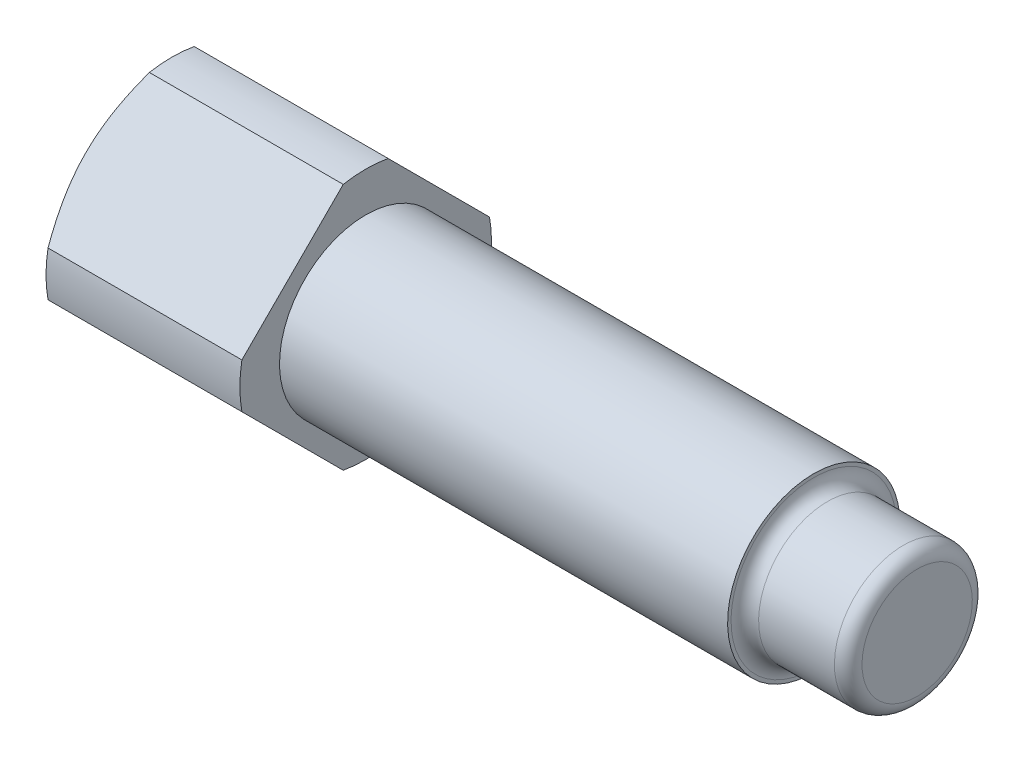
SolidWorks part; units mm, degrees
ref_plane "Front" through (0, 0, 0) normal (0, 0, 1) x (1, 0, 0)
ref_plane "Top" through (0, 0, 0) normal (0, 1, 0) x (1, 0, 0)
ref_plane "Right" through (0, 0, 0) normal (1, 0, 0) x (0, 0, -1)
sketch "Sketch1" plane through (0, 0, 0) normal (1, 0, 0) x (0, 0, -1)
  circle A0 centre (0, 0) radius 3.65
  dimension "e" = 7.3
extrude "BaseHead" add sketch "Sketch1" along normal blind 6
sketch "Sketch2" plane through (0, 2.3932, 1.1752) normal (-1, 0, 0) x (0, 0, 1)
  line L1 (3.0675, -2.3932) -> (-1.1752, 1.8494)
  line L2 (-1.1752, 1.8494) -> (-5.4178, -2.3932)
  line L3 (-5.4178, -2.3932) -> (-1.1752, -6.6359)
  line L4 (-1.1752, -6.6359) -> (3.0675, -2.3932)
  circle A0 centre (-1.1752, -2.3932) radius 3 construction
  dimension "s" = 6
extrude "Cut-Extrude1" cut sketch "Sketch2" against normal blind 6 flip side to cut
sketch "Sketch3" plane through (1.2597, -5.2747, 0) normal (0, 0, 1) x (0, -1, 0)
  line L0 (-9.2897, -1.2597) -> (-8.2747, -1.2597)
  line L2 (-8.2747, -1.2597) -> (-9.2897, -0.6737)
  line L3 (-9.2897, -0.6737) -> (-9.2897, -1.2597)
  line L4 (-5.2747, 0.2856) -> (-5.2747, -6.82) construction
  line L6 (-5.9259, -1.2597) -> (-8.8662, -1.2597) construction
  dimension "D1" = 8.03
  dimension "d2" = 6
  dimension "D3" = 30
revolve "Cut-Revolve1" cut sketch "Sketch3" angle 360 about L4
sketch "Sketch4" plane through (-6.1302, 8.6302, 0) normal (0, 0, 1) x (0, -1, 0)
  line L0 (8.6302, 12.1302) -> (11.1302, 12.1302)
  line L1 (12.2216, 12.1302) -> (9.2814, 12.1302) construction
  line L2 (11.1302, 12.1302) -> (11.1302, 25.1302)
  line L3 (8.6302, 28.1302) -> (10.6302, 28.1302)
  line L4 (10.6302, 25.1302) -> (10.6302, 28.1302)
  line L5 (8.6302, 28.1302) -> (8.6302, 12.1302)
  line L6 (8.6302, 12.6966) -> (8.6302, -1.2396) construction
  line L8 (11.1302, 25.1302) -> (10.6302, 25.1302)
  dimension "d" = 5
  dimension "l" = 16
  dimension "dp" = 4
  dimension "z" = 3
revolve "BaseBody" add sketch "Sketch4" angle 360 about L6
fillet "Fillet1" radius 0.4 2 edges at (19, 2, 0) (22, 2, 0)
fillet "HeadFillet" [suppressed] radius 0.2
sketch "Sketch5" plane through (0, 0, 0) normal (0, 0, 1) x (1, 0, 0)
  line L0 (19, 2.2835) -> (19.125, 2.5)
  line L1 (19.125, 2.5) -> (19.125, 2.75)
  line L2 (19.125, 2.75) -> (18.875, 2.75)
  line L3 (18.875, 2.75) -> (18.875, 2.5)
  line L4 (18.875, 2.5) -> (19, 2.2835)
  line L5 (0, 0) -> (22.6153, 0) construction
  line L6 (19, -2.5) -> (19, 2.5) construction
  dimension "D1" = 5
  dimension "D2" = 0.25
revolve "Cut-Revolve10" [suppressed] cut sketch "Sketch5" angle 360 about L5
pattern_linear "LPattern10" [suppressed] count 33 spacing 0.3 along (1, 0, 0)
equation "\"D1@Fillet1\" = 2 * \"r@HeadFillet\""
equation "\"d2@Sketch3\" = \"s@Sketch2\""
equation "\"D1@Sketch3\" = \"e@Sketch1\" * 1.1"
equation "\"k+c@BaseHead\" = \"k@Cut-Extrude1\""
equation "\"D2@Sketch5\" =  ( \"d@Sketch4\" - \"d@ThreadCosmetic1\" )  / 2"
equation "\"D1@Sketch5\" = \"d@Sketch4\""
equation "\"D3@LPattern10\" = \"D2@Sketch5\" * 1.2"
equation "\"D1@LPattern10\" = \"D1@ThreadCosmetic1\" / \"D3@LPattern10\""
